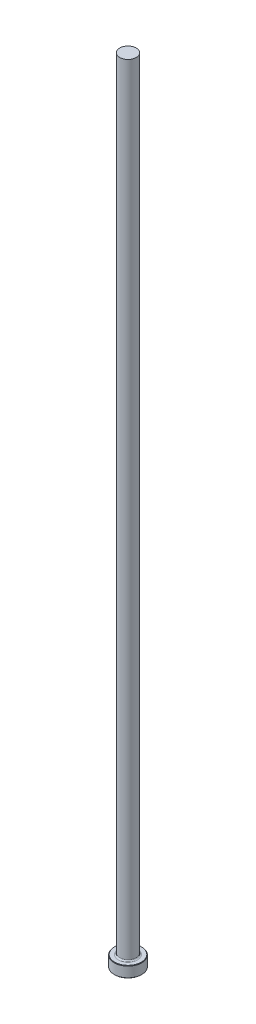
SolidWorks part; units mm, degrees
ref_plane "Front Plane" through (0, 0, 0) normal (0, 0, 1) x (1, 0, 0)
ref_plane "Top Plane" through (0, 0, 0) normal (0, 1, 0) x (1, 0, 0)
ref_plane "Right Plane" through (0, 0, 0) normal (1, 0, 0) x (0, 0, -1)
sketch "Sketch1" plane through (0, 0, 0) normal (0, 0, 1) x (1, 0, 0)
  line L0 (0, 259.9588) -> (0, -15.1925) construction
  line L1 (0, 0) -> (-7.9375, 0)
  line L2 (-7.9375, 0) -> (-7.9375, 6.35)
  line L3 (-7.9375, 6.35) -> (-4.7625, 6.35)
  line L4 (-4.7625, 6.35) -> (-4.7625, 457.2)
  line L5 (-4.7625, 457.2) -> (0, 457.2)
  line L6 (0, 457.2) -> (0, 0)
  dimension "L" = 457.2
  dimension "H" = 15.875
  dimension "T" = 6.35
  dimension "D" = 9.525
revolve "Revolve1" add sketch "Sketch1" angle 360 about L0
chamfer "Chamfer1" distance 0.254 angle 45 2 edges at (0, 6.35, 7.9375) (0, 0, 7.9375)
fillet "Fillet1" radius 0.762 1 edges at (0, 6.35, 4.7625)
sketch "Pocket Sketch" plane through (0, 0, 0) normal (0, 0, 1) x (1, 0, 0)
  line L0 (-8.3344, 0) -> (-8.3344, 6.3754)
  line L1 (-8.3344, 6.3754) -> (-5.9214, 6.3754)
  line L2 (-5.1594, 7.1374) -> (-5.1594, 22.225)
  line L3 (-5.1594, 22.225) -> (0, 22.225)
  line L4 (0, 22.225) -> (0, 0)
  line L5 (0, 0) -> (-8.3344, 0)
  line L6 (0, 12.6104) -> (0, -2.4989) construction
  line L7 (-7.9375, 6.096) -> (-7.9375, 0.254) construction
  line L8 (7.6835, 6.35) -> (-7.6835, 6.35) construction
  line L9 (-4.7625, 457.2) -> (-4.7625, 7.112) construction
  line L10 (-5.9214, 6.3754) -> (-5.1594, 7.1374)
  point P3 (-5.1594, 6.3754)
  dimension "D1" = 16.6687
  dimension "D2" = 0.3969
  dimension "D3" = 0.0254
  dimension "D4" = 0.3969
  dimension "D5" = 10.3187
  dimension "D6" = 22.225
